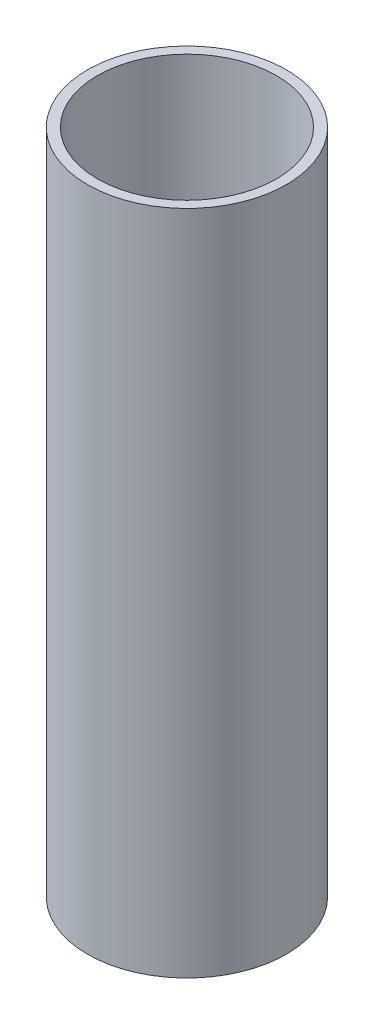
SolidWorks part; units mm, degrees
ref_plane "Front Plane" through (0, 0, 0) normal (0, 0, 1) x (1, 0, 0)
ref_plane "Top Plane" through (0, 0, 0) normal (0, 1, 0) x (1, 0, 0)
ref_plane "Right Plane" through (0, 0, 0) normal (1, 0, 0) x (0, 0, -1)
sketch "Sketch1" plane through (0, 0, 0) normal (0, 1, 0) x (1, 0, 0)
  circle A0 centre (0, 0) radius 40
  circle A1 centre (0, 0) radius 36
  dimension "D1" = 80
  dimension "D2" = 72
extrude "Extrude1" add sketch "Sketch1" along normal blind 268
